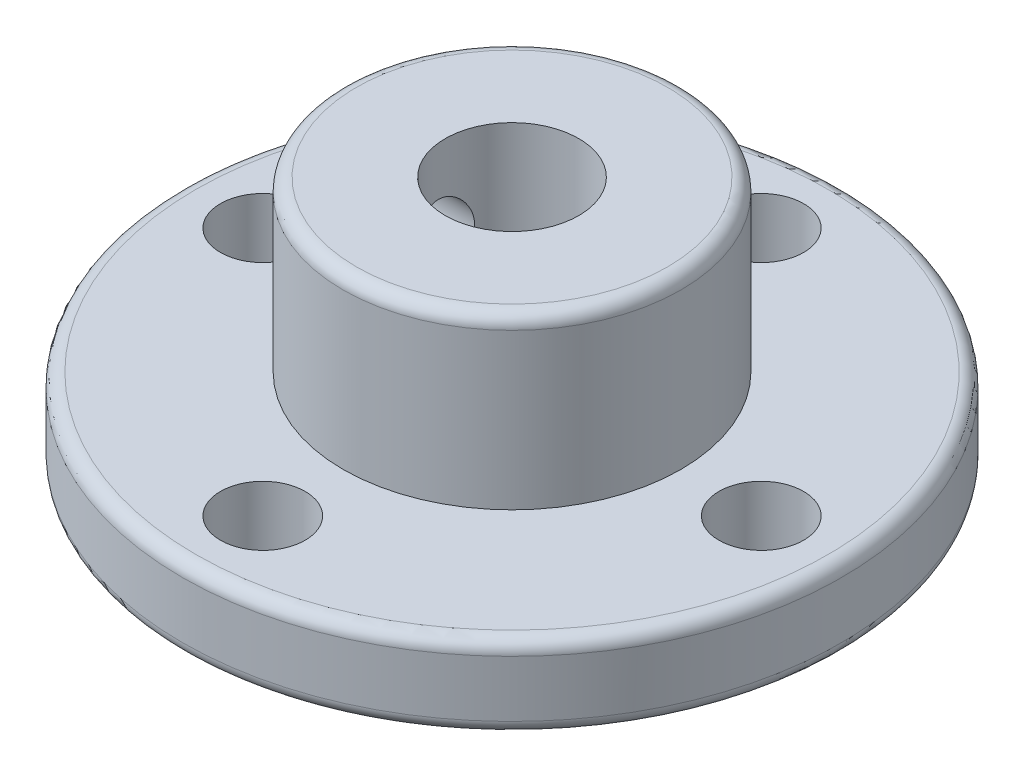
SolidWorks part; units mm, degrees
other "<MirrorPart.mount>-<<Part.mount>-<Imported1>>"
ref_plane "Front Plane" through (0, 0, 0) normal (0, 0, 1) x (1, 0, 0)
ref_plane "Top Plane" through (0, 0, 0) normal (0, 1, 0) x (1, 0, 0)
ref_plane "Right Plane" through (0, 0, 0) normal (1, 0, 0) x (0, 0, -1)
mirrored part "MirrorPart.mount_Mirrored"
